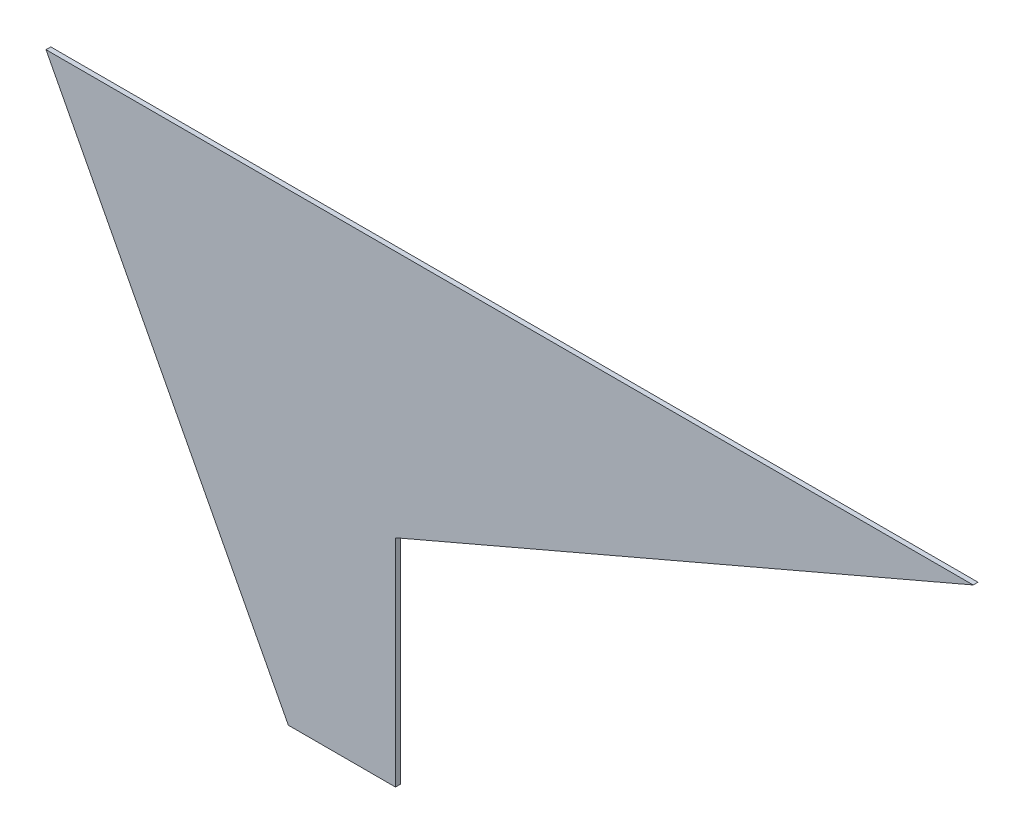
SolidWorks part; units mm, degrees
ref_plane "前视基准面" through (0, 0, 0) normal (0, 0, 1) x (1, 0, 0)
ref_plane "上视基准面" through (0, 0, 0) normal (0, 1, 0) x (1, 0, 0)
ref_plane "右视基准面" through (0, 0, 0) normal (1, 0, 0) x (0, 0, -1)
sketch "草图1" plane through (0, 0, 0) normal (0, 0, 1) x (1, 0, 0)
  line L0 (-33.5, 0) -> (33.5, 0)
  line L1 (0, 0) -> (0, 290) construction
  line L2 (-185, 290) -> (185, 290)
  line L3 (-185, 290) -> (-33.5, 0)
  line L4 (185, 290) -> (33.5, 0)
  dimension "D1" = 290
  dimension "D2" = 370
  dimension "D3" = 67
extrude "凸台-拉伸1" add sketch "草图1" along normal blind 3
sketch "草图2" plane through (0, 0, 3) normal (0, 0, 1) x (1, 0, 0)
  line L1 (33.5, 0) -> (185, 0)
  line L2 (33.5, 0) -> (33.5, 290)
  line L3 (33.5, 290) -> (185, 290)
  line L4 (185, 0) -> (185, 290)
extrude "切除-拉伸1" cut sketch "草图2" against normal blind 3
sketch "草图3" plane through (0, 0, 0) normal (0, 0, 1) x (1, 0, 0)
  line L0 (33.5, 135) -> (394.6309, 290)
  line L1 (33.5, 290) -> (33.5, 0) construction
  line L2 (394.6309, 290) -> (33.5, 290)
  line L3 (-33.5, 0) -> (33.5, 0) construction
  line L4 (33.5, 290) -> (33.5, 135)
  dimension "D1" = 135
extrude "凸台-拉伸2" add sketch "草图3" along normal blind 3
